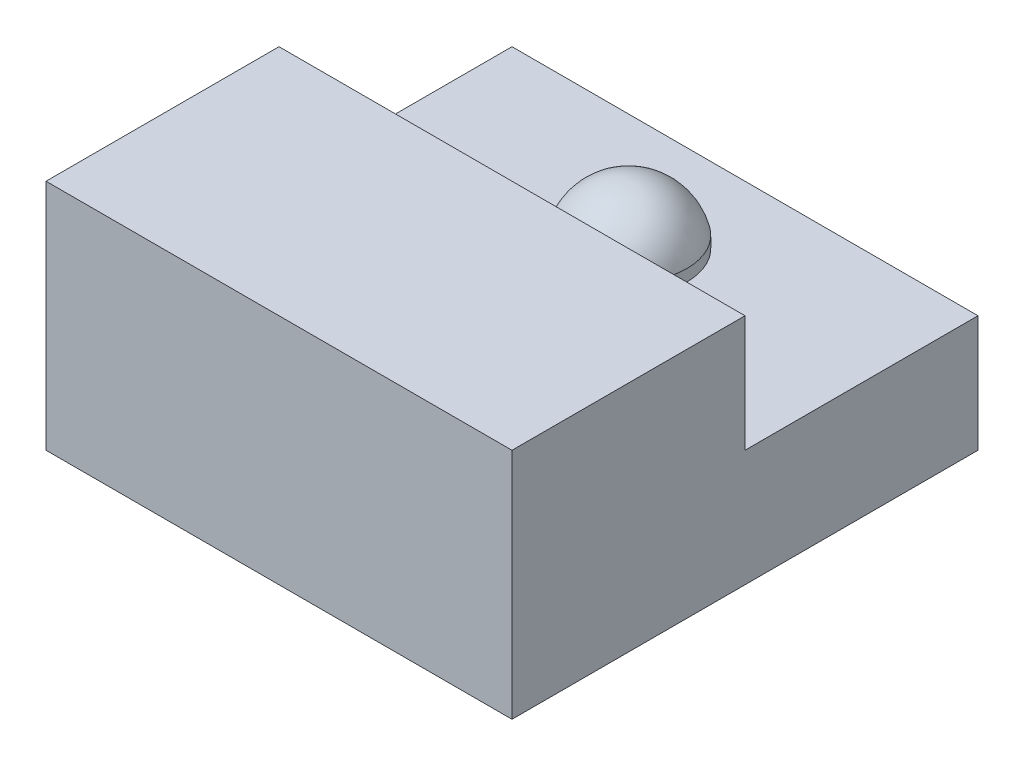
SolidWorks part; units mm, degrees
ref_plane "Face" through (0, 0, 0) normal (0, 0, 1) x (1, 0, 0)
ref_plane "Dessus" through (0, 0, 0) normal (0, 1, 0) x (1, 0, 0)
ref_plane "Droite" through (0, 0, 0) normal (1, 0, 0) x (0, 0, -1)
sketch "Esquisse1" plane through (0, 0, 0) normal (0, 0, 1) x (1, 0, 0)
  line L0 (0, 0) -> (2, 0) construction
  line L1 (-2, 0.5) -> (2, 0.5)
  line L2 (-2, 0.5) -> (-2, -0.5)
  line L3 (-2, -0.5) -> (2, -0.5)
  line L4 (2, 0.5) -> (2, -0.5)
  line L5 (0, 0) -> (0, -0.5) construction
  dimension "D1" = 4
  dimension "D2" = 1
extrude "Prisme de base" add sketch "Esquisse1" along normal mid plane 4
sketch "Esquisse2" plane through (0, 0.5, 0) normal (0, 1, 0) x (-1, 0, 0)
  line L0 (-2, 2) -> (-2, -2) construction
  line L1 (2, 2) -> (-2, 2)
  line L2 (2, 2) -> (2, 0)
  line L3 (2, 0) -> (-2, 0)
  line L4 (-2, 2) -> (-2, 0)
extrude "Extrusion1" add sketch "Esquisse2" along normal blind 1
sketch "Esquisse3" plane through (0, 0.5, 0) normal (0, 1, 0) x (-1, 0, 0)
  circle A0 centre (0, -1) radius 0.5
  dimension "D1" = 1
  dimension "D2" = 1
extrude "Extrusion2" add sketch "Esquisse3" along normal blind 0.1
dome "Dôme1" faces to dome 1 distance 0.4 parameters "D1"=0.4
